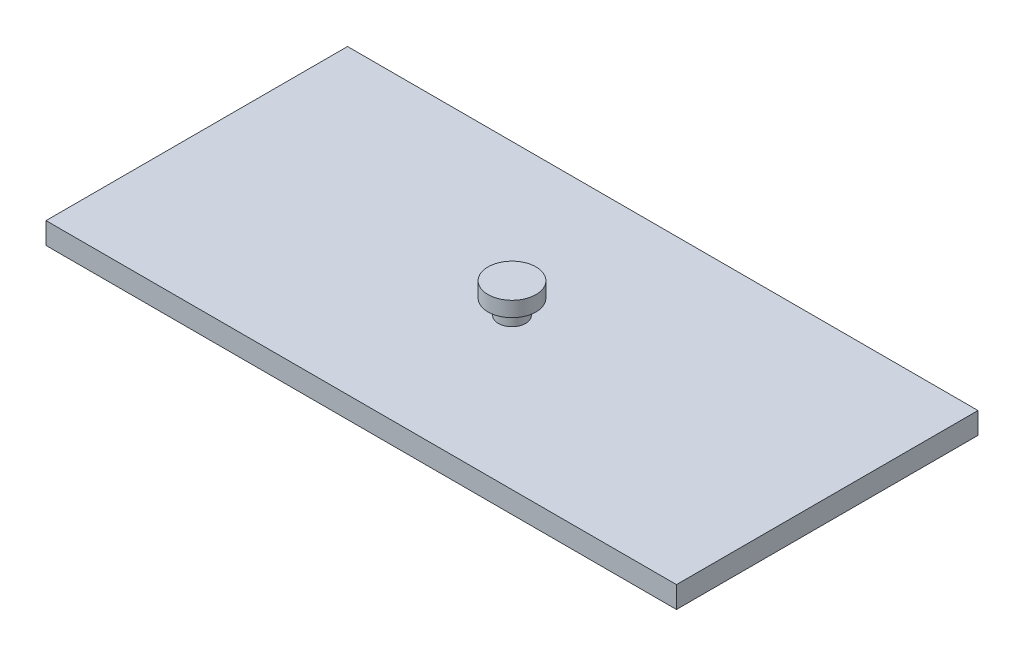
SolidWorks part; units mm, degrees
ref_plane "Front Plane" through (0, 0, 0) normal (0, 0, 1) x (1, 0, 0)
ref_plane "Top Plane" through (0, 0, 0) normal (0, 1, 0) x (1, 0, 0)
ref_plane "Right Plane" through (0, 0, 0) normal (1, 0, 0) x (0, 0, -1)
sketch "Sketch1" plane through (0, 0, 0) normal (0, 1, 0) x (1, 0, 0)
  line L1 (-58.42, 27.94) -> (58.42, 27.94)
  line L2 (-58.42, 27.94) -> (-58.42, -27.94)
  line L3 (-58.42, -27.94) -> (58.42, -27.94)
  line L4 (58.42, 27.94) -> (58.42, -27.94)
  line L5 (-58.42, 27.94) -> (58.42, -27.94) construction
  line L6 (-58.42, -27.94) -> (58.42, 27.94) construction
  point P0 (0, 0)
  dimension "D1" = 55.88
  dimension "D2" = 116.84
extrude "Boss-Extrude1" add sketch "Sketch1" along normal blind 4
sketch "Sketch4" plane through (0, 4, 0) normal (0, 1, 0) x (1, 0, 0)
  circle A0 centre (0, 0) radius 2.54
  dimension "D1" = 5.08
extrude "Boss-Extrude3" add sketch "Sketch4" along normal blind 2.794
sketch "Sketch5" plane through (0, 6.794, 0) normal (0, 1, 0) x (1, 0, 0)
  circle A0 centre (0, 0) radius 4.445
  dimension "D1" = 8.89
extrude "Boss-Extrude4" add sketch "Sketch5" along normal blind 2.794
sketch "Sketch10" plane through (0, 0, 0) normal (0, -1, 0) x (1, 0, 0)
  line L0 (-58.42, 27.94) -> (58.42, 27.94) construction
  line L1 (-55.626, 25.146) -> (-45.466, 25.146)
  line L2 (-55.626, 25.146) -> (-55.626, 14.986)
  line L3 (-55.626, 14.986) -> (-45.466, 14.986)
  line L4 (-45.466, 25.146) -> (-45.466, 14.986)
  line L5 (-55.626, 25.146) -> (-45.466, 14.986) construction
  line L6 (-55.626, 14.986) -> (-45.466, 25.146) construction
  line L7 (-58.42, -27.94) -> (-58.42, 27.94) construction
  point P0 (-50.546, 20.066)
  dimension "D1" = 10.16
  dimension "D2" = 10.16
  dimension "D3" = 2.794
  dimension "D4" = 2.794
extrude "Boss-Extrude6" add sketch "Sketch10" along normal blind 2.794
mirror "Mirror3" about plane through (0, 0, 0) normal (1, 0, 0) of "Boss-Extrude6"
mirror "Mirror4" about plane through (0, 0, 0) normal (0, 0, 1) of "Mirror3", "Boss-Extrude6"
